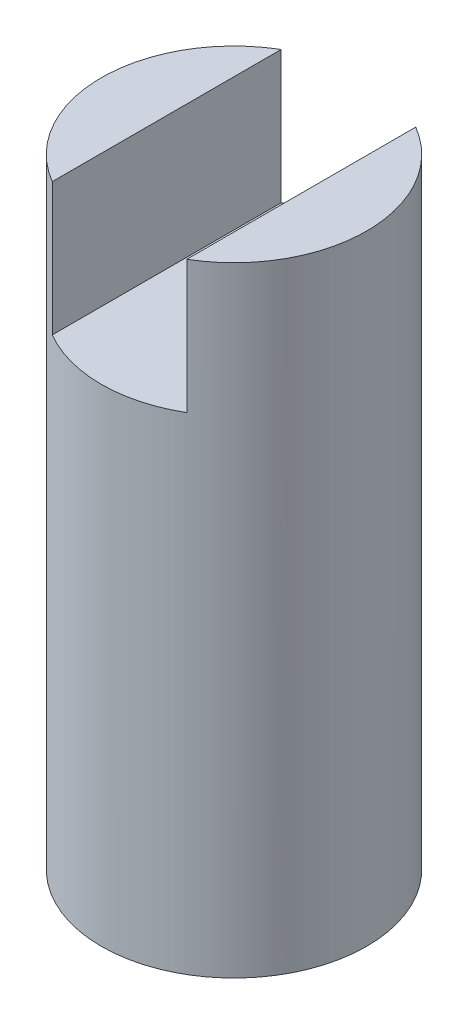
SolidWorks part; units mm, degrees
ref_plane "Plan de face" through (0, 0, 0) normal (0, 0, 1) x (1, 0, 0)
ref_plane "Plan de dessus" through (0, 0, 0) normal (0, 1, 0) x (1, 0, 0)
ref_plane "Plan de droite" through (0, 0, 0) normal (1, 0, 0) x (0, 0, -1)
sketch "Esquisse1" plane through (0, 0, 0) normal (0, 1, 0) x (1, 0, 0)
  circle A0 centre (0, 0) radius 15
  dimension "D1" = 30
extrude "Extrusion1" add sketch "Esquisse1" along normal blind 70
hole_wizard "Trou taraudé M6x1.01" positions "Esquisse3" profile "Esquisse2" tap size "M6x1.0" standard "ISO"
sketch "Esquisse3" plane through (0, 0, 0) normal (0, -1, 0) x (1, 0, 0)
  point P0 (0, 0)
sketch "Esquisse2" plane through (0, 0, 0) normal (1, 0, 0) x (0, 0, -1)
  line L0 (0, 0) -> (0, 16.5022)
  line L1 (0, 16.5022) -> (2.5, 15)
  line L2 (2.5, 15) -> (2.5, 0)
  line L5 (2.5, 0) -> (0, 0)
  line L10 (0, 16.5022) -> (-2.5, 15) construction
  line L11 (0, -6.35) -> (0, 107.95) construction
  dimension "Diamètre du trou pour taraudage" = 5
  dimension "Profondeur du trou pour taraudage" = 15
  dimension "Angle de pointe" = 118
sketch "Esquisse4" plane through (0, 0, 0) normal (1, 0, 0) x (0, 0, -1)
  line L0 (-15, 0) -> (15, 0) construction
  line L1 (-25, 55) -> (25, 55)
  line L2 (-25, 55) -> (-25, 85)
  line L3 (-25, 85) -> (25, 85)
  line L4 (25, 55) -> (25, 85)
  line L5 (15, 0) -> (15, 70) construction
  dimension "D1" = 50
  dimension "D2" = 30
  dimension "D3" = 55
  dimension "D4" = 10
extrude "Enlèv. mat.-Extru.1" cut sketch "Esquisse4" against normal mid plane 15.2
